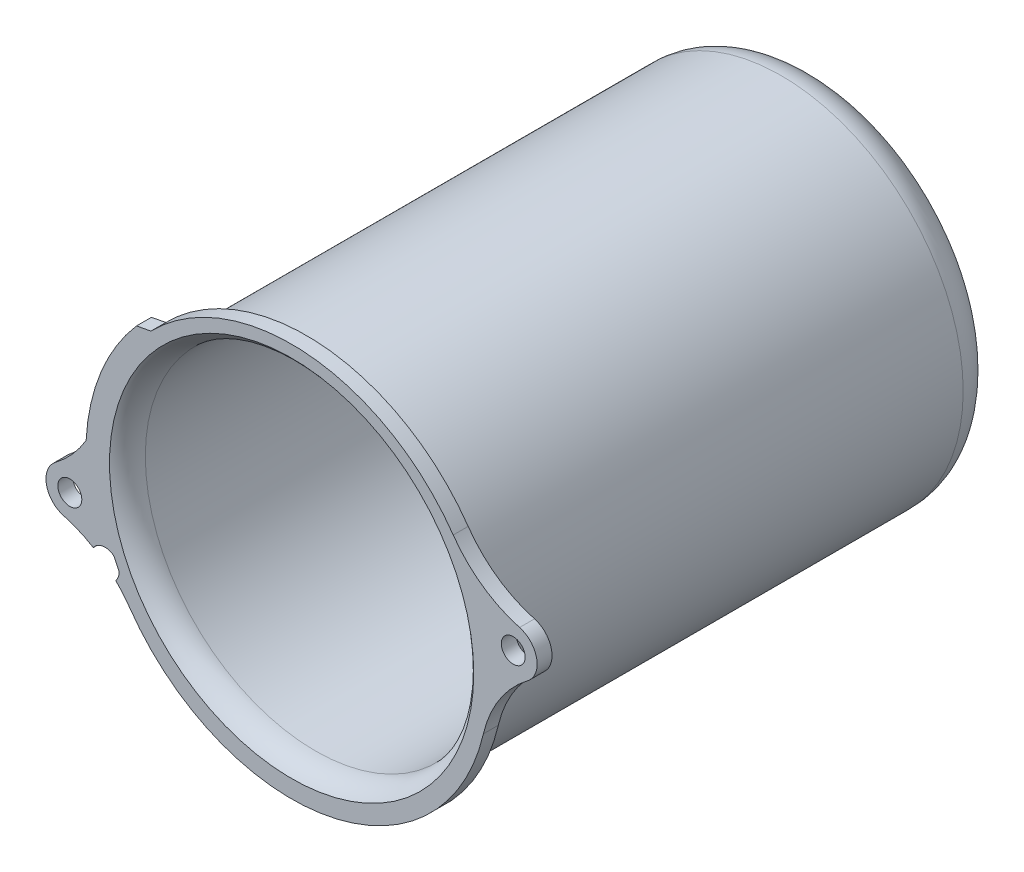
SolidWorks part; units mm, degrees
ref_plane "Plane1" through (0, 0, 0) normal (0, 0, 1) x (1, 0, 0)
ref_plane "Plane2" through (0, 0, 0) normal (0, 1, 0) x (1, 0, 0)
ref_plane "Plane3" through (0, 0, 0) normal (1, 0, 0) x (0, 0, -1)
sketch "Esquisse1" plane through (0, 0, 0) normal (0, 0, 1) x (1, 0, 0)
  line L0 (-23.5689, 23.1272) -> (-25.9858, 22.6679)
  line L1 (-0.0121, 0.0171) -> (-10.2725, 53.4827) construction
  line L2 (37.1315, 7.1452) -> (-0.0121, 0.0171) construction
  circle A0 centre (-37.1557, -7.111) radius 2
  arc A1 (38.1919, 11.0021) -> (27.0764, 18.8641) centre (43.4938, 30.2866) cw
  arc A2 (39.5443, 3.9549) -> (32.1289, -7.4634) centre (51.6082, -11.997) ccw
  arc A3 (-38.2161, -10.9679) -> (-39.5685, -3.9206) centre (-37.1557, -7.111) cw
  arc A4 (39.5443, 3.9549) -> (38.1919, 11.0021) centre (37.1315, 7.1452) ccw
  arc A6 (-38.2161, -10.9679) -> (-33.2163, -13.1096) centre (-43.518, -30.2523) cw
  arc A7 (27.0764, 18.8641) -> (-23.5689, 23.1272) centre (-0.0121, 0.0171) ccw
  arc A8 (-39.5685, -3.9206) -> (-34.4271, 1.8345) centre (-51.6325, 12.0312) ccw
  arc A9 (-27.1007, -18.8299) -> (32.1289, -7.4634) centre (-0.0121, 0.0171) ccw
  circle A10 centre (-0.0121, 0.0171) radius 31
  arc A11 (-29.4767, -16.0101) -> (-33.2163, -13.1096) centre (-31.2604, -14.4488) ccw
  arc A12 (-29.4767, -16.0101) -> (-27.1007, -18.8299) centre (-43.518, -30.2523) cw
  circle A13 centre (37.1315, 7.1452) radius 2
  arc A14 (-25.9858, 22.6679) -> (-34.4271, 1.8345) centre (-0.0121, 0.0171) ccw
  dimension "D1" = 20
  dimension "D2" = 33
  dimension "D13" = 4
  dimension "D28" = 62
extrude "Base-Extrusion" add sketch "Esquisse1" along normal blind 2.5
sketch "Esquisse2" plane through (0, 0, 0) normal (1, 0, 0) x (0, 0, -1)
  line L0 (0, 32.5) -> (0, 33)
  line L1 (0, 0.4729) -> (0.2313, 0.49) construction
  line L2 (85.5, 25) -> (85.5, 13.5)
  line L3 (86.5, 12.5) -> (90.5, 12.5)
  line L4 (94.5, 8.5) -> (94.5, 0.5)
  line L5 (91.5, 11) -> (84.8417, 11)
  line L6 (83.5, 25) -> (83.5, 13.5)
  line L7 (91.5, 10.2321) -> (91.5, 11)
  line L8 (92.5, 8.5) -> (92.5, 0.5)
  line L9 (0, 33) -> (-2.5, 33)
  line L11 (-2.5, 33) -> (-2.5, 31)
  line L12 (1.5, 29) -> (79.5, 29)
  line L13 (1.5, 31) -> (79.5, 31)
  line L14 (94.5, 0.5) -> (92.5, 0.5)
  line L15 (0, 0.4729) -> (0.2264, 0.49) construction
  line L17 (0.2313, 0.49) -> (101.5213, 0.49) construction
  arc A0 (0, 32.5) -> (1.5, 31) centre (1.5, 32.5) ccw
  arc A1 (83.5, 25) -> (79.5, 29) centre (79.5, 25) ccw
  arc A2 (-2.5, 31) -> (1.5, 29) centre (1.5, 34) ccw
  arc A3 (85.5, 25) -> (79.5, 31) centre (79.5, 25) ccw
  arc A4 (86.5, 12.5) -> (85.5, 13.5) centre (86.5, 13.5) cw
  arc A5 (94.5, 8.5) -> (90.5, 12.5) centre (90.5, 8.5) ccw
  arc A6 (83.5, 13.5) -> (84.8417, 11) centre (86.5, 13.5) ccw
  arc A7 (92.5, 8.5) -> (91.5, 10.2321) centre (90.5, 8.5) ccw
  point P31 (83.5, 29)
  point P35 (85.5, 31)
  dimension "D1" = 0.01
revolve "Boss.-Révol.2" add sketch "Esquisse2" angle 360 about L17
